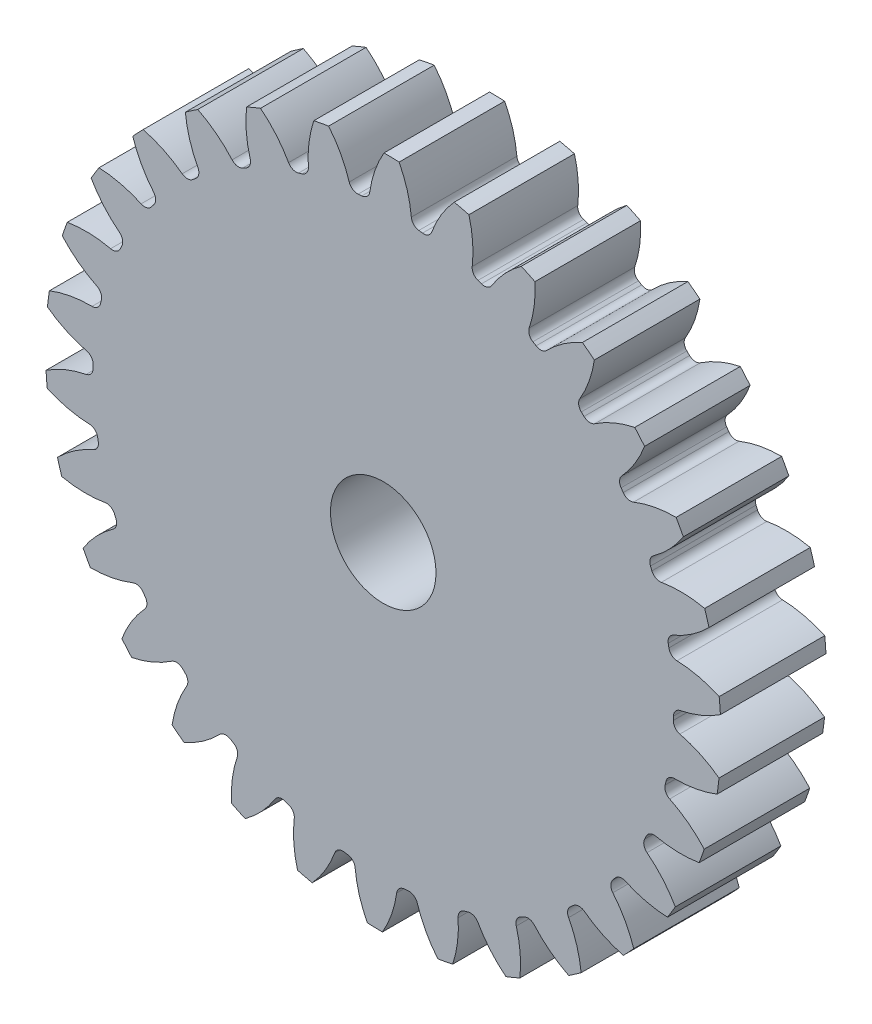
SolidWorks part; units mm, degrees
ref_plane "Front" through (0, 0, 0) normal (0, 0, 1) x (1, 0, 0)
ref_plane "Top" through (0, 0, 0) normal (0, 1, 0) x (1, 0, 0)
ref_plane "Right" through (0, 0, 0) normal (1, 0, 0) x (0, 0, -1)
sketch "Sketch3" plane through (0, 0, 0) normal (0, 0, 1) x (1, 0, 0)
  circle A0 centre (0, 0) radius 325.12
  dimension "od" = 650.24
extrude "gearBody" add sketch "Sketch3" along normal blind 101.6
sketch "Sketch2" plane through (0, 0, 0) normal (0, 0, 1) x (1, 0, 0)
  line L0 (0, 0) -> (264.616, 109.6075) construction
  line L1 (323.7825, -35.1145) -> (0, 0) construction
  line L2 (0, 0) -> (36.3143, 0) construction
  line L3 (304.6846, 8.3875) -> (303.9004, -23.4) construction
  line L5 (304.2925, -7.5062) -> (0, 0) construction
  line L7 (0, 0) -> (286.4183, 0) construction
  arc A0 (286.4031, 2.9478) -> (285.9095, -17.0655) centre (0, 0) ccw construction
  arc A1 (324.579, 18.7482) -> (323.2598, -34.7289) centre (0, 0) ccw construction
  arc A2 (304.6846, 8.3875) -> (303.9004, -23.4) centre (0, 0) ccw construction
  arc A3 (279.2649, -8.6873) -> (279.3536, -5.0926) centre (0, 0) ccw
  arc A4 (323.7825, -35.1145) -> (285.5089, -16.9637) centre (258.8899, -122.5213) ccw
  arc A5 (323.7825, -35.1145) -> (325.12, 19.1075) centre (0, 0) ccw
  arc A6 (325.12, 19.1075) -> (285.9981, 2.8658) centre (264.616, 109.6075) cw
  arc A7 (279.3536, -5.0926) -> (285.9981, 2.8658) centre (287.6225, -5.2433) cw
  arc A8 (285.5089, -16.9637) -> (279.2649, -8.6873) centre (287.5312, -8.9445) cw
  point P6 (325.12, 19.1075)
  point P22 (323.7825, -35.1145)
  dimension "baseDia" = 572.8366
  dimension "od" = 650.24
  dimension "pd" = 609.6
  dimension "rd" = 558.8
  dimension "rFillet" = 8.2702
  dimension "pointX" = 325.12
  dimension "pointY" = 19.1075
  dimension "CTT" = 31.7875
  dimension "flankCenterAngle" = 22.5
extrude "toothCut" cut sketch "Sketch2" along normal through all
pattern_circular "CirPattern1" count 30 over 360 about axis through (0, 0, 0) along (0, 0, 1) of "toothCut"
sketch "hub1Dia" plane through (0, 0, 0) normal (0, 0, -1) x (-1, 0, 0)
  circle A0 centre (0, 0) radius 12.7
  dimension "hub1Dia" = 25.4
sketch "hub2Dia" plane through (0, 0, 101.6) normal (0, 0, 1) x (1, 0, 0)
  circle A0 centre (0, 0) radius 12.7
  dimension "hub2dia" = 25.4
sketch "boreDia" plane through (0, 0, 0) normal (0, 0, 1) x (1, 0, 0)
  circle A0 centre (0, 0) radius 50.8
  dimension "boreDia" = 101.6
extrude "bore" cut sketch "boreDia" against normal mid plane 25400
